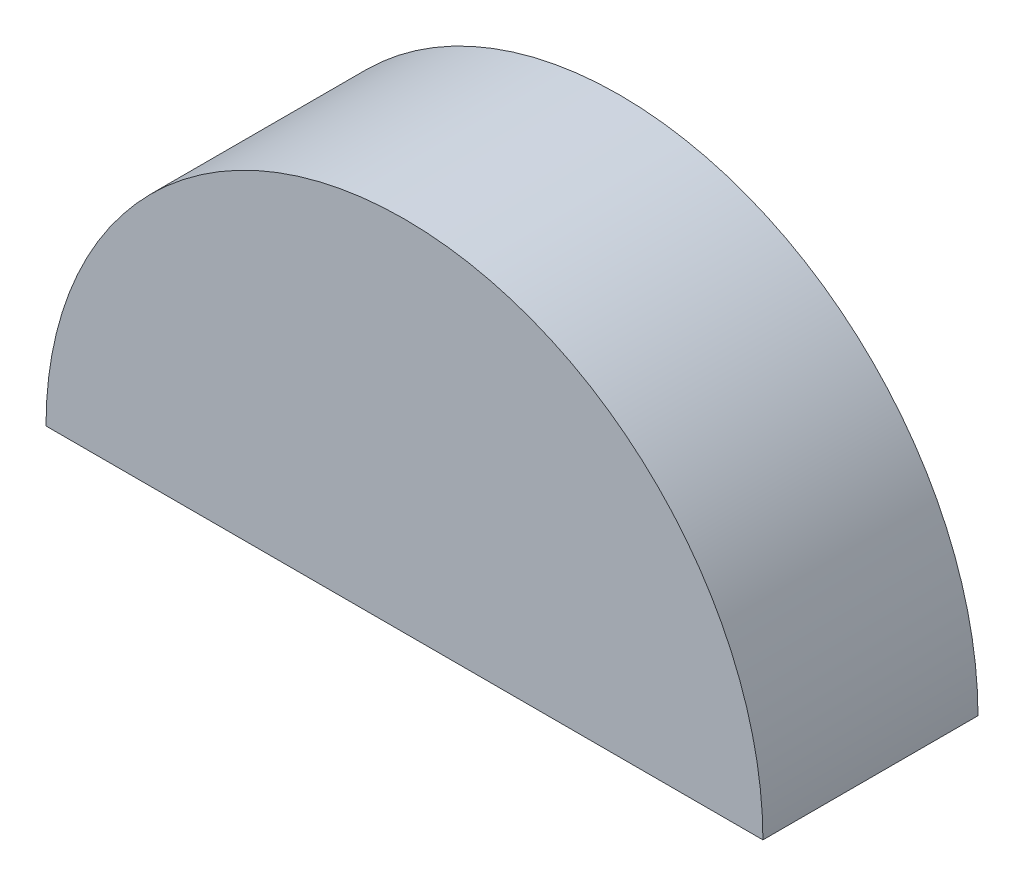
SolidWorks part; units mm, degrees
ref_plane "Plan de face" through (0, 0, 0) normal (0, 0, 1) x (1, 0, 0)
ref_plane "Plan de dessus" through (0, 0, 0) normal (0, 1, 0) x (1, 0, 0)
ref_plane "Plan de droite" through (0, 0, 0) normal (1, 0, 0) x (0, 0, -1)
sketch "Esquisse1" plane through (0, 0, 0) normal (0, 0, 1) x (1, 0, 0)
  line L0 (0, 0) -> (10, 0)
  arc A0 (10, 0) -> (0, 0) centre (5, 0) ccw
  dimension "D1" = 10
extrude "Boss.-Extru.1" add sketch "Esquisse1" along normal blind 3
